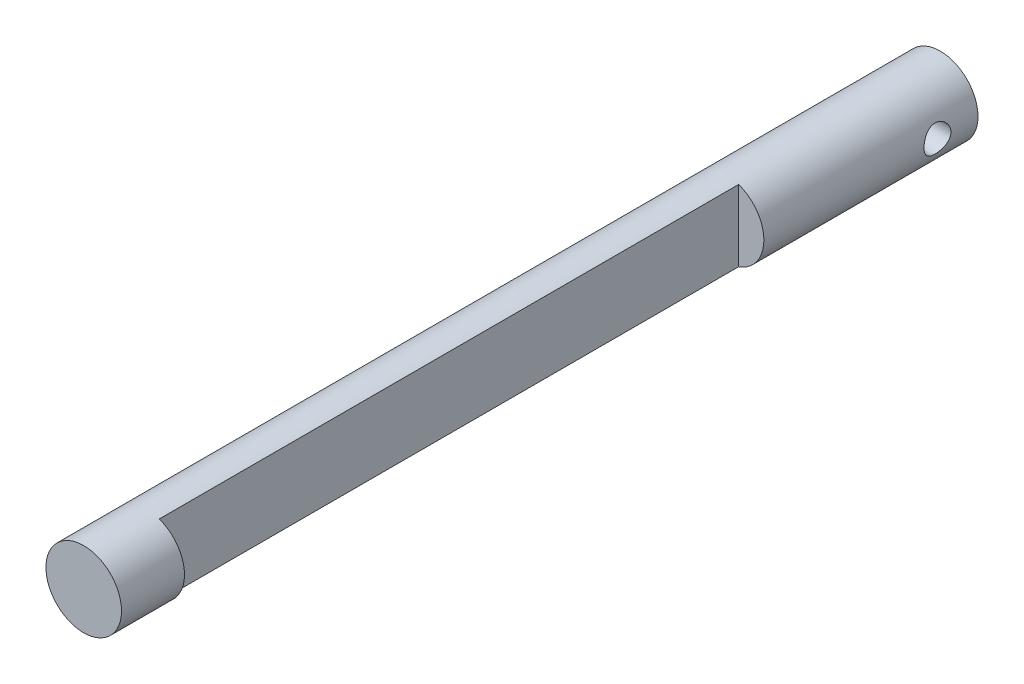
SolidWorks part; units mm, degrees
ref_plane "Plan1" through (0, 0, 0) normal (0, 0, 1) x (1, 0, 0)
ref_plane "Plan2" through (0, 0, 0) normal (0, 1, 0) x (1, 0, 0)
ref_plane "Plan3" through (0, 0, 0) normal (1, 0, 0) x (0, 0, -1)
sketch "Esquisse1" plane through (0, 0, 0) normal (0, 0, 1) x (1, 0, 0)
  circle A0 centre (0, 0) radius 0.75
  dimension "D1" = 1.5
extrude "Base-Extrusion" add sketch "Esquisse1" along normal blind 17
sketch "Esquisse2" plane through (0, 0, 0) normal (0, 1, 0) x (1, 0, 0)
  line L0 (0, 0) -> (0.25, 0) construction
  line L3 (0.25, -4.25) -> (3.3718, -4.25)
  line L7 (-1, 0) -> (-1, -20.9469) construction
  line L8 (0.75, 0) -> (-0.75, 0) construction
  line L9 (0, 0) -> (-10, 0) construction
  line L11 (0.25, -4.25) -> (0.25, -15.75)
  line L12 (3.3718, -4.25) -> (3.3718, -15.75)
  line L13 (3.3718, -15.75) -> (0.25, -15.75)
  dimension "D1" = 11.5
  dimension "D2" = 0.25
  dimension "D3" = 4.25
  dimension "D4" = 3.1218
extrude "Enlèv. mat.-Extru.1" cut sketch "Esquisse2" against normal mid plane 10
sketch "Esquisse5" plane through (0, 0, 0) normal (1, 0, 0) x (0, 0, -1)
  line L0 (0, 0) -> (-21.2418, 0) construction
  line L1 (-15.75, 0) -> (-4.25, 0) construction
  circle A1 centre (-0.8036, 0) radius 0.2675
extrude "Enlèv. mat.-Extru.2" cut sketch "Esquisse5" against normal mid plane 2
